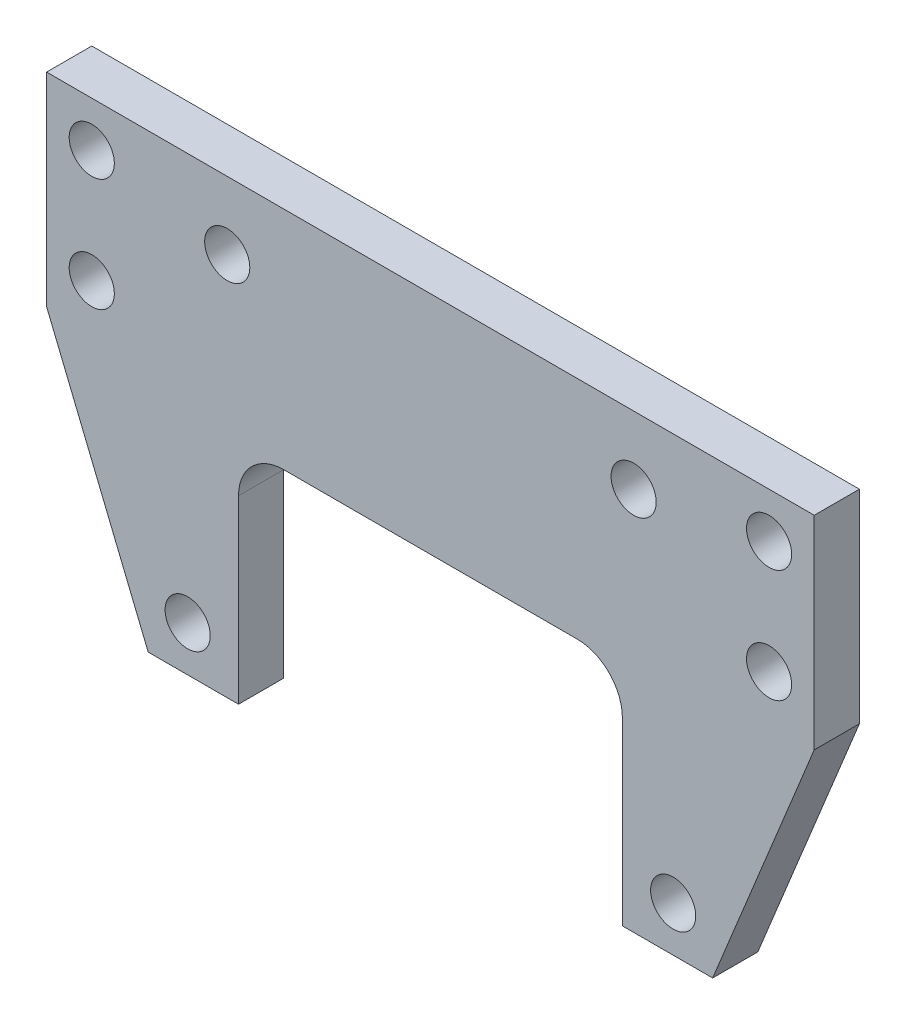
SolidWorks part; units mm, degrees
ref_plane "Front Plane" through (0, 0, 0) normal (0, 0, 1) x (1, 0, 0)
ref_plane "Top Plane" through (0, 0, 0) normal (0, 1, 0) x (1, 0, 0)
ref_plane "Right Plane" through (0, 0, 0) normal (1, 0, 0) x (0, 0, -1)
sketch "Sketch1" plane through (0, 0, 0) normal (0, 0, 1) x (1, 0, 0)
  line L0 (0, 0) -> (53.975, 0)
  line L1 (53.975, 0) -> (53.975, -63.5)
  line L2 (53.975, -63.5) -> (26.9875, -63.5)
  line L3 (26.9875, -63.5) -> (26.9875, -31.75)
  line L4 (26.9875, -31.75) -> (-26.9875, -31.75)
  line L5 (-26.9875, -31.75) -> (-26.9875, -63.5)
  line L6 (-26.9875, -63.5) -> (-53.975, -63.5)
  line L7 (-53.975, -63.5) -> (-53.975, 0)
  line L8 (-53.975, 0) -> (0, 0)
  line L9 (0, 0) -> (0, 32.4418) construction
  line L10 (-15.875, -14.1932) -> (-15.875, -72.3159) construction
  line L11 (15.875, -14.1932) -> (15.875, -72.3159) construction
  line L12 (-39.6875, -63.5) -> (-53.975, -28.575)
  line L13 (39.6875, -63.5) -> (53.975, -28.575)
  circle A0 centre (-34.1376, -57.15) radius 3.175
  circle A1 centre (34.1376, -57.15) radius 3.175
  circle A2 centre (28.575, -9.525) radius 3.175
  circle A3 centre (-28.575, -9.525) radius 3.175
  circle A4 centre (47.625, -6.35) radius 3.175
  circle A5 centre (47.625, -22.225) radius 3.175
  circle A6 centre (-47.625, -6.35) radius 3.175
  circle A7 centre (-47.625, -22.225) radius 3.175
  dimension "D5" = 6.35
  dimension "D17" = 6.35
  dimension "D1" = 53.975
  dimension "D2" = 31.75
  dimension "D3" = 63.5
  dimension "D4" = 107.95
  dimension "D6" = 68.2752
  dimension "D7" = 9.525
  dimension "D8" = 57.15
  dimension "D9" = 57.15
  dimension "D10" = 31.75
  dimension "D11" = 38.1
  dimension "D12" = 12.7
  dimension "D13" = 34.925
  dimension "D14" = 6.35
  dimension "D15" = 6.35
  dimension "D16" = 15.875
sketch "Sketch2" plane through (0, 0, 0) normal (0, 0, 1) x (1, 0, 0)
  line L0 (-26.9875, -63.5) -> (-53.975, -63.5) construction
  line L1 (-53.975, -63.5) -> (-53.975, 0) construction
  line L2 (-53.975, 0) -> (0, 0) construction
  line L3 (0, 0) -> (53.975, 0) construction
  line L4 (53.975, 0) -> (53.975, -63.5) construction
  line L5 (53.975, -63.5) -> (26.9875, -63.5) construction
  line L6 (26.9875, -63.5) -> (26.9875, -31.75) construction
  line L7 (26.9875, -31.75) -> (-26.9875, -31.75) construction
  line L8 (-26.9875, -31.75) -> (-26.9875, -63.5) construction
  line L9 (-26.9875, -63.5) -> (-39.6875, -63.5)
  line L10 (-53.975, -28.575) -> (-53.975, 0)
  line L11 (-53.975, 0) -> (0, 0)
  line L12 (0, 0) -> (53.975, 0)
  line L13 (53.975, 0) -> (53.975, -28.575)
  line L14 (39.6875, -63.5) -> (26.9875, -63.5)
  line L15 (26.9875, -63.5) -> (26.9875, -31.75)
  line L16 (26.9875, -31.75) -> (-26.9875, -31.75)
  line L17 (-26.9875, -31.75) -> (-26.9875, -63.5)
  line L18 (-39.6875, -63.5) -> (-53.975, -28.575) construction
  line L19 (39.6875, -63.5) -> (53.975, -28.575) construction
  line L20 (-39.6875, -63.5) -> (-53.975, -28.575)
  line L21 (39.6875, -63.5) -> (53.975, -28.575)
  circle A0 centre (-34.1376, -57.15) radius 3.175 construction
  circle A1 centre (-28.575, -9.525) radius 3.175 construction
  circle A2 centre (28.575, -9.525) radius 3.175 construction
  circle A3 centre (34.1376, -57.15) radius 3.175 construction
  circle A4 centre (-34.1376, -57.15) radius 3.175
  circle A5 centre (-28.575, -9.525) radius 3.175
  circle A6 centre (28.575, -9.525) radius 3.175
  circle A7 centre (34.1376, -57.15) radius 3.175
  circle A8 centre (-47.625, -22.225) radius 3.175 construction
  circle A9 centre (-47.625, -6.35) radius 3.175 construction
  circle A10 centre (47.625, -6.35) radius 3.175 construction
  circle A11 centre (47.625, -22.225) radius 3.175 construction
  circle A12 centre (-47.625, -22.225) radius 3.175
  circle A13 centre (-47.625, -6.35) radius 3.175
  circle A14 centre (47.625, -6.35) radius 3.175
  circle A15 centre (47.625, -22.225) radius 3.175
extrude "Boss-Extrude1" add sketch "Sketch2" along normal blind 6.35
fillet "Fillet1" radius 6.35 2 edges at (26.9875, -31.75, 3.175) (-26.9875, -31.75, 3.175)
